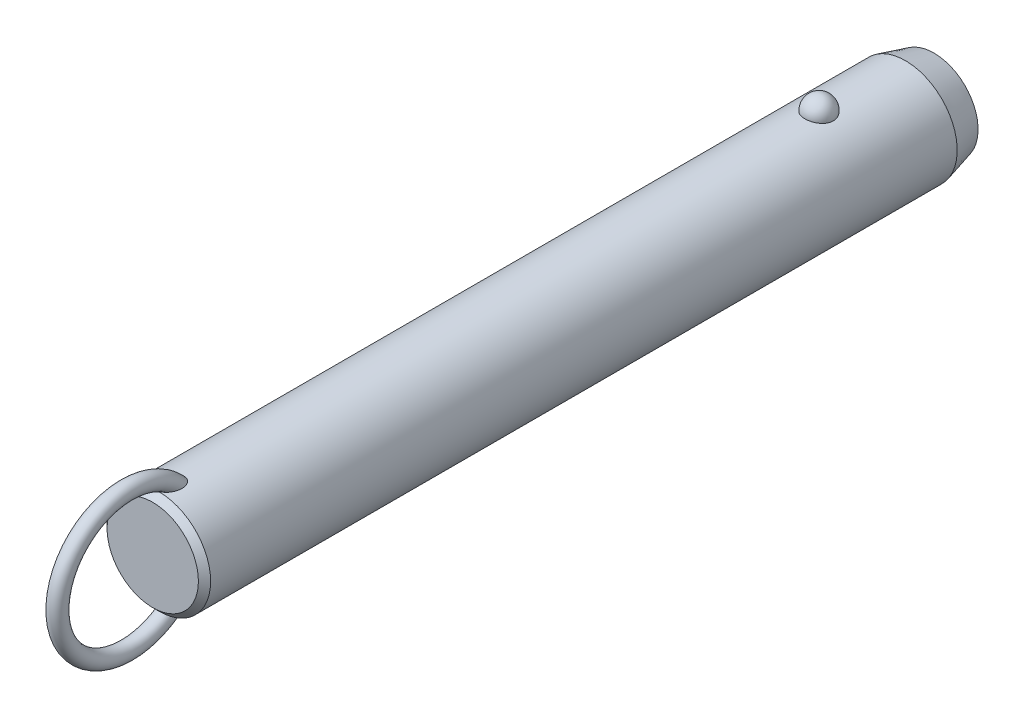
SolidWorks part; units mm, degrees
ref_plane "Front Plane" through (0, 0, 0) normal (0, 0, 1) x (1, 0, 0)
ref_plane "Top Plane" through (0, 0, 0) normal (0, 1, 0) x (1, 0, 0)
ref_plane "Right Plane" through (0, 0, 0) normal (1, 0, 0) x (0, 0, -1)
sketch "Sketch2" plane through (0, 0, 0) normal (0, 0, 1) x (1, 0, 0)
  circle A0 centre (0, 0) radius 12.7
  point P3 (0, 12.7)
  dimension "D1" = 25.4
extrude "Boss-Extrude1" add sketch "Sketch2" along normal blind 147.3
sketch "Sketch3" plane through (0, 0, 0) normal (0, 0, -1) x (-1, 0, 0)
  circle A0 centre (0, 0) radius 12.7
  dimension "D1" = 25.4
extrude "Boss-Extrude2" add sketch "Sketch3" along normal blind 31.7
chamfer "Chamfer1" distance 7 angle 15 1 edges at (-12.7, 0, -31.7)
sketch "Sketch12" plane through (0, 0, 0) normal (1, 0, 0) x (0, 0, -1)
  line L0 (-147.3, 12.7) -> (-147.3, -12.7) construction
  point P0 (-147.3, 0)
sketch "Sketch13" plane through (0, 0, 0) normal (1, 0, 0) x (0, 0, -1)
  circle A0 centre (-166.35, 0) radius 19.05
  point P2 (-147.3, 0)
  dimension "D1" = 38.1
sketch "Sketch14" plane through (0, 0, 0) normal (0, 1, 0) x (1, 0, 0)
  circle A0 centre (0, -149.3) radius 2
  point P2 (0, -147.3)
  dimension "D1" = 4
sweep "Sweep1" add profiles "Sketch14" path "Sketch13"
sketch "Sketch15" plane through (0, 0, 147.3) normal (0, 0, 1) x (1, 0, 0)
  circle A0 centre (0, 0) radius 12.7
  dimension "D1" = 25.4
extrude "Boss-Extrude3" add sketch "Sketch15" along normal blind 12.7
chamfer "Chamfer2" distance 1.5 angle 45 1 edges at (12.7, 0, 160)
sketch "Sketch18" plane through (0, 0, 0) normal (1, 0, 0) x (0, 0, -1)
  line L0 (24.7, 12.7) -> (-152.151, 12.7) construction
  line L1 (3.5, 16.2) -> (3.5, 9.2)
  line L2 (-152.151, -12.7) -> (24.7, -12.7) construction
  arc A0 (3.5, 16.2) -> (3.5, 9.2) centre (3.5, 12.7) ccw
  point P4 (0, 12.7)
  dimension "D1" = 28.9
revolve "Revolve1" add sketch "Sketch18" angle 360 about L1
